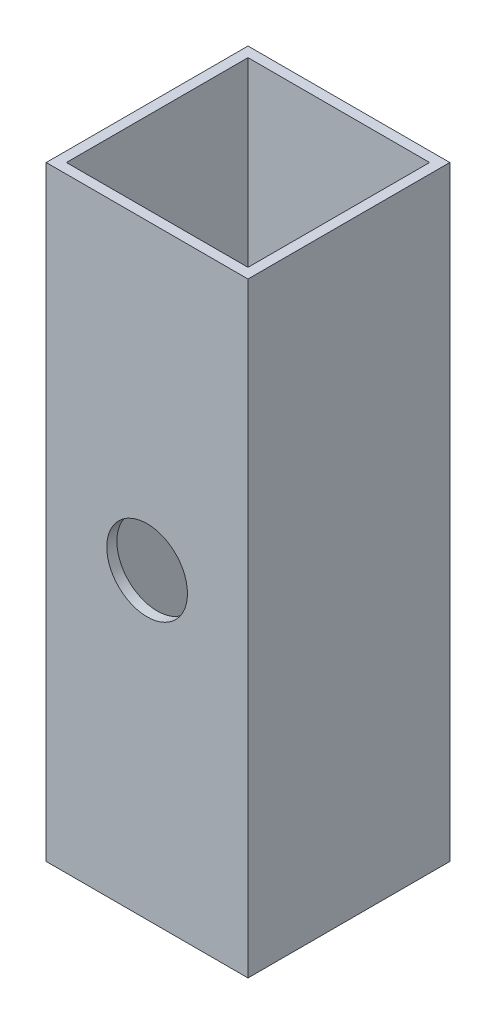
SolidWorks part; units mm, degrees
ref_plane "Front Plane" through (0, 0, 0) normal (0, 0, 1) x (1, 0, 0)
ref_plane "Top Plane" through (0, 0, 0) normal (0, 1, 0) x (1, 0, 0)
ref_plane "Right Plane" through (0, 0, 0) normal (1, 0, 0) x (0, 0, -1)
sketch "Sketch1" plane through (0, 0, 0) normal (0, 1, 0) x (1, 0, 0)
  line L1 (-25, 25) -> (25, 25)
  line L2 (-25, 25) -> (-25, -25)
  line L3 (-25, -25) -> (25, -25)
  line L4 (25, 25) -> (25, -25)
  line L5 (-25, 25) -> (25, -25) construction
  line L6 (-25, -25) -> (25, 25) construction
  point P0 (0, 0)
  dimension "D1" = 50
extrude "Boss-Extrude1" add sketch "Sketch1" along normal blind 150
shell "Shell1" thickness 2.5
sketch "Sketch2" plane through (0, 0, 25) normal (0, 0, 1) x (1, 0, 0)
  circle A0 centre (0, 75) radius 10
  dimension "D1" = 20
extrude "Cut-Extrude1" cut sketch "Sketch2" against normal through all
